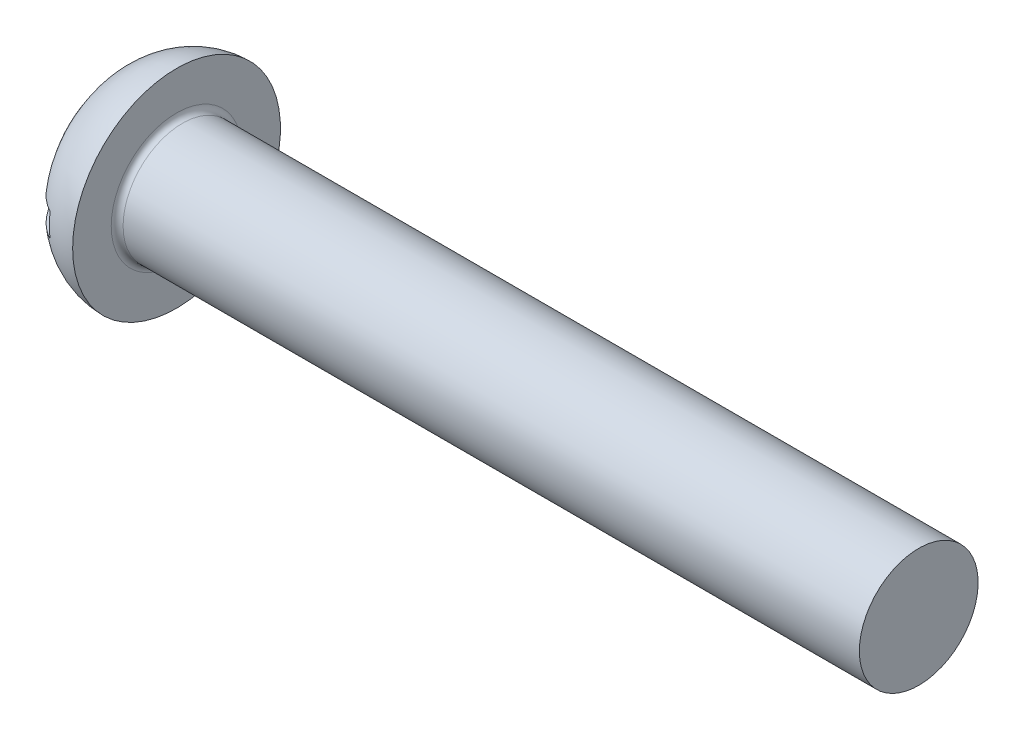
SolidWorks part; units mm, degrees
ref_plane "Front Plane" through (0, 0, 0) normal (0, 0, 1) x (1, 0, 0)
ref_plane "Top Plane" through (0, 0, 0) normal (0, 1, 0) x (1, 0, 0)
ref_plane "Right Plane" through (0, 0, 0) normal (1, 0, 0) x (0, 0, -1)
other "Configuration Table"
sketch "BodySke" plane through (0, 0, 0) normal (0, 0, 1) x (1, 0, 0)
  line L0 (0, 0) -> (111.3824, 0) construction
  line L1 (0, 0) -> (0, 8) construction
  line L2 (5.4, 4) -> (5.4, 7)
  line L4 (5.4, 4) -> (55.4, 4)
  line L5 (55.4, 4) -> (55.4, 0)
  line L6 (6.65, 7.824) -> (6.65, -6.8939) construction
  line L7 (0, 0) -> (55.4, 0)
  line L8 (25.4, 8.824) -> (25.4, -4.958) construction
  arc A0 (5.4, 7) -> (1.888, 5.306) centre (5.4541, 2.4003) ccw
  arc A1 (1.888, 5.306) -> (0, 0) centre (8.4, 0) ccw
  point P10 (55.4, 3.4455)
revolve "BaseBody" add sketch "BodySke" angle 360 about L0
fillet "Fillet1" radius 0.4 1 edges at (5.4, 0, 4)
sketch "SlotSke" plane through (0, 0, 0) normal (1, 0, 0) x (0, 0, -1)
  line L1 (7, 0.8) -> (-7, 0.8)
  line L3 (7, 0.8) -> (7, -0.8)
  line L5 (7, -0.8) -> (-7, -0.8)
  line L6 (-7, 0.8) -> (-7, -0.8)
extrude "Slot" cut sketch "SlotSke" along normal blind 3.3
sketch "ThdSchSke" plane through (0, 0, 0) normal (0, 0, 1) x (1, 0, 0)
  line L0 (0, 0) -> (55.1256, 0) construction
  line L1 (0, 0) -> (111.3824, 0) construction
  line L2 (55.0799, 4) -> (55.0799, 4.6403)
  line L3 (55.0799, 4.6403) -> (55.7201, 4.6403)
  line L4 (55.7201, 4.6403) -> (55.7201, 4)
  line L5 (55.7201, 4) -> (55.4, 3.4455)
  line L6 (55.4, 3.4455) -> (55.0799, 4)
  line L7 (5.4, 4) -> (55.4, 4) construction
  line L13 (55.4, 4) -> (55.4, 0) construction
revolve "ThreadSchematic" [suppressed] cut sketch "ThdSchSke" angle 360 about L0
pattern_linear "ThdSchPat" [suppressed] count 24 along (1, 0, 0)
equation "\"Thread_minor@ThreadCosmetic\" = \"Thread_minor@BodySke\""
equation "\"Advance@ThdSchPat\" = \"Advance@BodySke\""
equation "\"D1@ThdSchPat\" =  int( \"Thread_length@BodySke\" / \"Advance@ThdSchPat\" ) "
equation "\"D1@SlotSke\" = \"Head_dia@BodySke\""
equation "\"D2@SlotSke\" = \"D1@SlotSke\" / 2"
equation "\"D4@SlotSke\" = \"Slot_width@SlotSke\" / 2"
